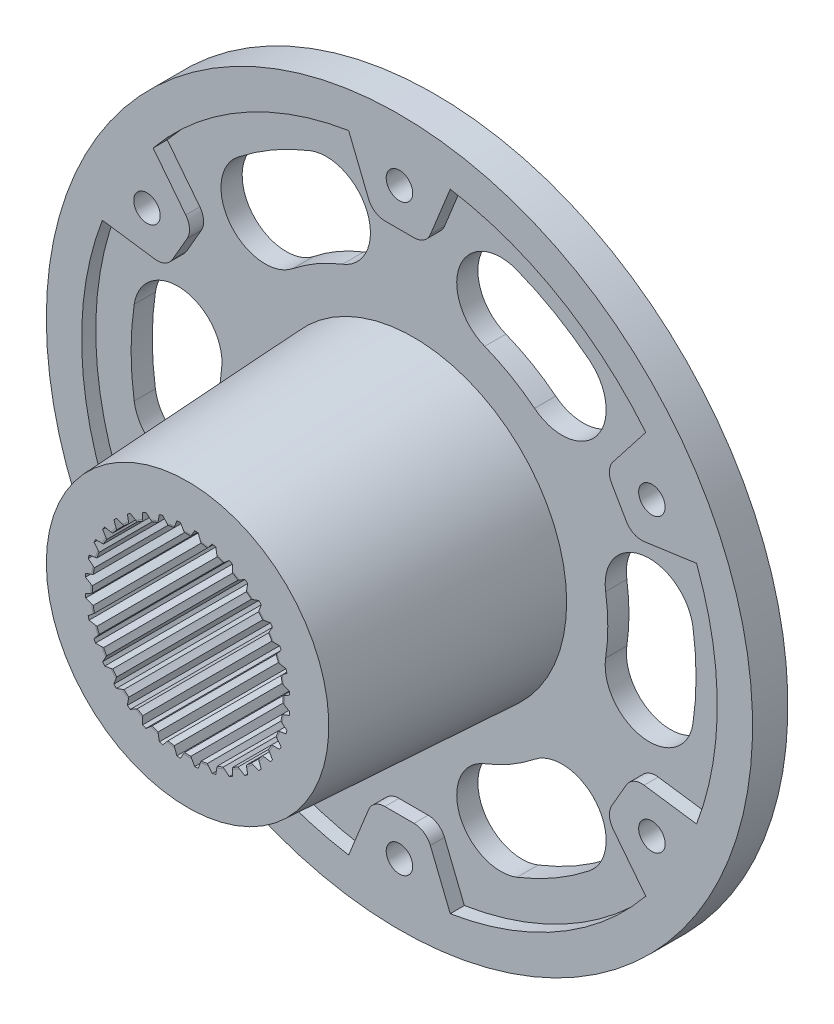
SolidWorks part; units mm, degrees
ref_plane "Front Plane" through (0, 0, 0) normal (0, 0, 1) x (1, 0, 0)
ref_plane "Top Plane" through (0, 0, 0) normal (0, 1, 0) x (1, 0, 0)
ref_plane "Right Plane" through (0, 0, 0) normal (1, 0, 0) x (0, 0, -1)
sketch "Sketch1" plane through (0, 0, 0) normal (1, 0, 0) x (0, 0, -1)
  line L0 (0, 0) -> (-130.4466, 0) construction
  line L1 (0, 0) -> (0, 100)
  line L2 (0, 100) -> (-10, 100)
  line L3 (-10, 100) -> (-10, 90)
  line L4 (-6, 90) -> (-6, 0)
  line L5 (-6, 0) -> (0, 0)
  line L6 (-10, 90) -> (-6, 90)
  dimension "D1" = 180
  dimension "D2" = 200
  dimension "D3" = 6
  dimension "D5" = 10
revolve "Revolve1" add sketch "Sketch1" angle 360 about L0
sketch "Sketch2" plane through (0, 0, 0) normal (0, 0, -1) x (-1, 0, 0)
  circle A0 centre (0, 0) radius 40
  dimension "D1" = 80
extrude "Boss-Extrude1" add sketch "Sketch2" along normal through all draft 3 from offset 70
sketch "Sketch4" plane through (0, 0, 10) normal (0, 0, 1) x (1, 0, 0)
  line L0 (0, 0) -> (0, 100) construction
  line L1 (-14.3825, 88.8434) -> (-8.7634, 74.9356)
  line L2 (14.3825, 88.8434) -> (8.7634, 74.9356)
  line L3 (-4.1275, 71.8086) -> (4.1275, 71.8086)
  arc A1 (-4.1275, 71.8086) -> (-8.7634, 74.9356) centre (-4.1275, 76.8086) cw
  arc A2 (4.1275, 71.8086) -> (8.7634, 74.9356) centre (4.1275, 76.8086) ccw
  arc A3 (14.3825, 88.8434) -> (-14.3825, 88.8434) centre (0, 0) ccw
  circle A4 centre (0, 0) radius 90 construction
  circle A5 centre (0, 0) radius 100 construction
  point P11 (-7.5, 71.8086)
  point P14 (7.5, 71.8086)
  dimension "D3" = 5
  dimension "D1" = 15
  dimension "D2" = 22
  dimension "D4" = 15
extrude "Boss-Extrude3" add sketch "Sketch4" against normal up to next
sketch "Sketch5" plane through (0, 0, 10) normal (0, 0, 1) x (1, 0, 0)
  line L0 (0, 82.55) -> (0, 0) construction
  circle A0 centre (0, 82.55) radius 3.75
  circle A1 centre (0, 0) radius 82.55 construction
  dimension "D1" = 7.5
  dimension "D2" = 165.1
extrude "Cut-Extrude1" cut sketch "Sketch5" against normal through all
pattern_circular "CirPattern2" count 6 over 360 about axis through (0, 0, 0) along (0, 0, 1) of "Boss-Extrude3", "Cut-Extrude1"
sketch "Sketch6" plane through (0, 0, 6) normal (0, 0, 1) x (1, 0, 0)
  line L2 (0, 0) -> (51.6792, 89.511) construction
  line L3 (0, 0) -> (91.0119, 0) construction
  arc A0 (34.253, 43.0317) -> (49.8226, 62.5916) centre (42.0378, 52.8117) ccw
  arc A3 (49.8226, 62.5916) -> (29.2946, 74.4434) centre (0, 0) ccw
  arc A5 (34.253, 43.0317) -> (20.14, 51.1799) centre (0, 0) ccw
  arc A6 (20.14, 51.1799) -> (29.2946, 74.4434) centre (24.7173, 62.8117) cw
  dimension "D4" = 20
  dimension "D2" = 80
  dimension "D3" = 55
  dimension "D1" = 60
extrude "Cut-Extrude2" cut sketch "Sketch6" against normal through all
pattern_circular "CirPattern3" count 6 over 360 about axis through (0, 0, 0) along (0, 0, 1) of "Cut-Extrude2"
sketch "Sketch3" plane through (-8.0116, -2.7849, 70) normal (0, 0, 1) x (1, 0, 0)
  line L0 (8.0116, 2.7849) -> (8.0116, 28.2849) construction
  line L1 (8.0116, 2.7849) -> (33.5116, 2.7849) construction
  circle A0 centre (8.0116, 2.7849) radius 25.5
  circle A1 centre (8.0116, 2.7849) radius 40 construction
  dimension "D1" = 51
extrude "Cut-Extrude11" cut sketch "Sketch3" against normal through all draft 3
fillet "Fillet2" radius 2 1 edges at (25.5, 0, 70)
sketch "Sketch41" plane through (0, 0, 70) normal (0, 0, 1) x (1, 0, 0)
  circle A0 centre (0, 0) radius 27
  circle A1 centre (0, 0) radius 43.3541 construction
  dimension "Inside Diameter" = 54
extrude "Cut-Extrude21" cut sketch "Sketch41" against normal through all
sketch "Sketch51" plane through (0, 0, 70) normal (0, 0, 1) x (1, 0, 0)
  line L0 (0, 0) -> (69.7656, 0) construction
  line L1 (0, 0) -> (0, 47.2389) construction
  line L2 (0, 0) -> (49.3468, 4.3173) construction
  line L3 (26.9848, 0.9066) -> (28.9289, 2.029)
  line L5 (26.7322, 3.793) -> (28.8418, 3.0252)
  arc A1 (26.9848, 0.9066) -> (26.7322, 3.793) centre (0, 0) ccw
  arc A2 (28.8418, 3.0252) -> (28.9289, 2.029) centre (0, 0) cw
  circle A3 centre (0, 0) radius 27 construction
  dimension "D1" = 29
  dimension "D5" = 25
  dimension "D2" = 5
  dimension "D4" = 1
extrude "Cut-Extrude3" cut sketch "Sketch51" against normal through all
pattern_circular "CirPattern1" count 36 over 360 about axis through (0, 0, 0) along (0, 0, 1) of "Cut-Extrude3"
other "36 Spline (Casting)<1>"
